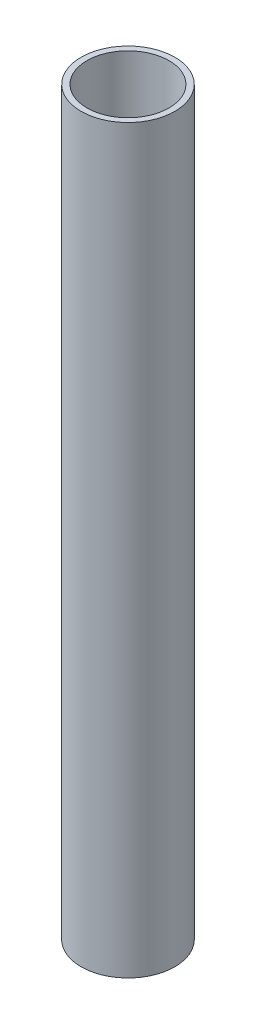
SolidWorks part; units mm, degrees
ref_plane "Front Plane" through (0, 0, 0) normal (0, 0, 1) x (1, 0, 0)
ref_plane "Top Plane" through (0, 0, 0) normal (0, 1, 0) x (1, 0, 0)
ref_plane "Right Plane" through (0, 0, 0) normal (1, 0, 0) x (0, 0, -1)
sketch "Sketch1" plane through (0, 0, 0) normal (0, 1, 0) x (1, 0, 0)
  circle A0 centre (0, 0) radius 6.35
  circle A1 centre (0, 0) radius 5.5563
  dimension "D1" = 12.7
  dimension "D2" = 11.1125
extrude "Boss-Extrude1" add sketch "Sketch1" along normal blind 100.33
